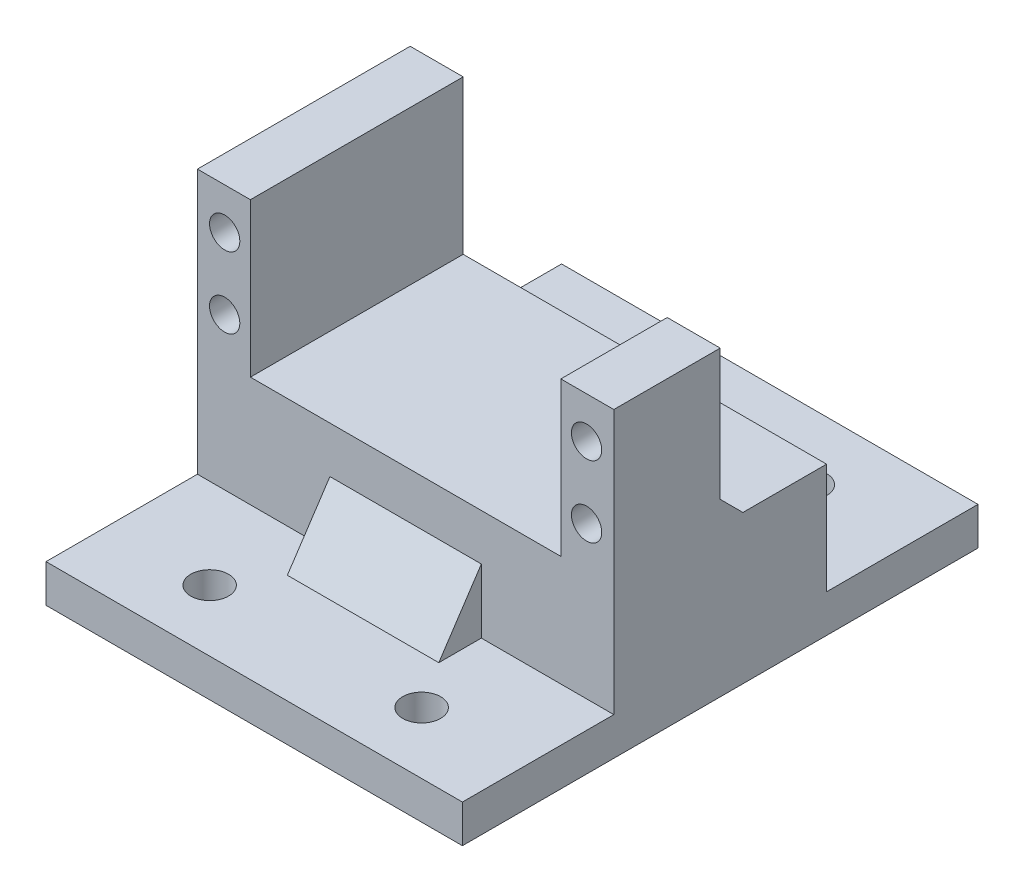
SolidWorks part; units mm, degrees
ref_plane "前视基准面" through (0, 0, 0) normal (0, 0, 1) x (1, 0, 0)
ref_plane "上视基准面" through (0, 0, 0) normal (0, 1, 0) x (1, 0, 0)
ref_plane "右视基准面" through (0, 0, 0) normal (1, 0, 0) x (0, 0, -1)
sketch "草图1" plane through (0, 0, 0) normal (0, 1, 0) x (1, 0, 0)
  line L1 (-18.8462, 12.2436) -> (36.1538, 12.2436)
  line L2 (-18.8462, 12.2436) -> (-18.8462, -15.8564)
  line L3 (-18.8462, -15.8564) -> (36.1538, -15.8564)
  line L4 (36.1538, 12.2436) -> (36.1538, -15.8564)
  dimension "D1" = 55
  dimension "D2" = 28.1
extrude "凸台-拉伸1" add sketch "草图1" along normal blind 39.9
sketch "草图2" plane through (0, 39.9, 0) normal (0, 1, 0) x (1, 0, 0)
  line L0 (8.6538, 12.2436) -> (-11.8462, 12.2436)
  line L1 (36.1538, 12.2436) -> (-18.8462, 12.2436) construction
  line L2 (-11.8462, 12.2436) -> (-11.8462, -15.8564)
  line L3 (-18.8462, -15.8564) -> (36.1538, -15.8564) construction
  line L4 (-11.8462, -15.8564) -> (29.1538, -15.8564)
  line L5 (29.1538, -15.8564) -> (29.1538, 12.2436)
  line L6 (29.1538, 12.2436) -> (8.6538, 12.2436)
extrude "切除-拉伸1" cut sketch "草图2" against normal blind 20.3
sketch "草图3" plane through (0, 0, 15.8564) normal (0, 0, 1) x (1, 0, 0)
  circle A0 centre (-15.2462, 34.45) radius 2
  circle A1 centre (-15.2462, 25.05) radius 2
  circle A2 centre (32.5538, 34.45) radius 2
  circle A3 centre (32.5538, 25.05) radius 2
extrude "切除-拉伸2" cut sketch "草图3" against normal blind 38
sketch "草图6" plane through (0, 0, -12.2436) normal (0, 0, -1) x (-1, 0, 0)
  line L0 (-36.1538, 0) -> (18.8462, 0) construction
  line L1 (-26.2872, 0) -> (10.5458, 0)
  line L2 (-26.2872, 0) -> (-26.2872, 2.8881)
  line L3 (-26.2872, 2.8881) -> (10.5458, 2.8881)
  line L4 (10.5458, 0) -> (10.5458, 2.8881)
extrude "切除-拉伸3" cut sketch "草图6" against normal blind 1
sketch "草图7" plane through (-18.8462, 0, 0) normal (-1, 0, 0) x (0, 0, 1)
  line L0 (-12.2436, 19.95) -> (-47.7434, 0)
  line L1 (-12.2436, 39.9) -> (-12.2436, 0) construction
  line L2 (-47.7434, 0) -> (-12.2436, 0)
  line L3 (-12.2436, 0) -> (-12.2436, 19.95)
  line L4 (15.8564, 19.95) -> (15.8564, 0)
  line L5 (15.8564, 39.9) -> (15.8564, 0) construction
  line L6 (15.8564, 39.9) -> (15.8564, 0) construction
  line L7 (15.8564, 0) -> (41.3165, 0)
  line L8 (41.3165, 0) -> (15.8564, 19.95)
extrude "凸台-拉伸2" add sketch "草图7" against normal up to surface (55 mm away)
sketch "草图9" plane through (0, 0, 0) normal (0, -1, 0) x (1, 0, 0)
  line L0 (36.1538, 41.3165) -> (36.1538, -47.7434) construction
  line L1 (-18.8462, -47.7434) -> (-18.8462, 41.3165) construction
  line L2 (36.1538, -47.7434) -> (-18.8462, -47.7434) construction
  circle A0 centre (-6.8462, -29.8049) radius 2.5
  circle A1 centre (24.1538, -29.7434) radius 2.5
  dimension "D1" = 12
  dimension "D2" = 12
  dimension "D3" = 18
extrude "切除-拉伸5" cut sketch "草图9" against normal blind 44
sketch "草图10" plane through (0, 0, 0) normal (0, -1, 0) x (1, 0, 0)
  circle A0 centre (-6.8462, 30.0096) radius 2.5
  circle A1 centre (24.1538, 30.0096) radius 2.5
extrude "切除-拉伸6" cut sketch "草图10" against normal blind 44
sketch "草图11" plane through (0, 39.9, 0) normal (0, 1, 0) x (1, 0, 0)
  circle A0 centre (24.1538, 29.7434) radius 4
  circle A1 centre (-6.8462, 29.8049) radius 4
  circle A2 centre (-6.8462, -30.0096) radius 4
  circle A3 centre (24.1538, -30.0096) radius 4
  dimension "D1" = 8
  dimension "D2" = 8
  dimension "D3" = 8
  dimension "D4" = 8
extrude "切除-拉伸10" cut sketch "草图11" against normal blind 33
sketch "草图12" plane through (36.1538, 0, 0) normal (1, 0, 0) x (0, 0, -1)
  line L0 (-15.8564, 19.95) -> (-15.8564, 0)
  line L1 (-41.3165, 0) -> (47.7434, 0) construction
  line L2 (-15.8564, 0) -> (-53.9257, 0)
  line L3 (-53.9257, 0) -> (-15.8564, 19.95)
  line L4 (12.2436, 19.95) -> (12.2436, 0)
  line L5 (12.2436, 0) -> (49.0857, 0)
  line L6 (49.0857, 0) -> (12.2436, 19.95)
extrude "切除-拉伸11" cut sketch "草图12" against normal blind 74
sketch "草图13" plane through (36.1538, 0, 0) normal (1, 0, 0) x (0, 0, -1)
  line L0 (-15.8564, 0) -> (-35.8564, 0)
  line L1 (-35.8564, 0) -> (-35.8564, 5)
  line L2 (-35.8564, 5) -> (-15.8564, 5)
  line L3 (-15.8564, 39.9) -> (-15.8564, 0) construction
  line L4 (-15.8564, 5) -> (-15.8564, 0)
  line L5 (12.2436, 0) -> (32.2436, 0)
  line L6 (-15.8564, 0) -> (12.2436, 0) construction
  line L7 (32.2436, 0) -> (32.2436, 5)
  line L8 (32.2436, 5) -> (12.2436, 5)
  line L9 (12.2436, 39.9) -> (12.2436, 0) construction
  line L10 (12.2436, 5) -> (12.2436, 0)
  dimension "D1" = 20
extrude "凸台-拉伸3" add sketch "草图13" against normal up to surface (55 mm away)
sketch "草图14" plane through (0, 5, 0) normal (0, 1, 0) x (1, 0, 0)
  line L1 (-18.8462, 12.2436) -> (-18.8462, 32.2436) construction
  line L2 (36.1538, 32.2436) -> (36.1538, 12.2436) construction
  line L3 (-18.8462, -35.8564) -> (-18.8462, -15.8564) construction
  line L4 (36.1538, -15.8564) -> (36.1538, -35.8564) construction
  circle A0 centre (-5.3462, 23.2642) radius 2.5
  circle A1 centre (22.6538, 23.2642) radius 2.5
  circle A2 centre (-5.3462, -27.741) radius 2.5
  circle A3 centre (22.6538, -27.741) radius 2.5
  point P14 (-18.8462, -25.8564)
  dimension "D1" = 13.5
  dimension "D3" = 13.5
  dimension "D4" = 13.5
  dimension "D2" = 13.5
extrude "切除-拉伸12" cut sketch "草图14" against normal blind 74
ref_plane "基准面1" through (8.6538, 0, 0) normal (-1, 0, 0) x (0, 0, 1)
sketch "草图16" plane through (8.6538, 0, 0) normal (-1, 0, 0) x (0, 0, 1)
  line L0 (-12.2436, 13.4787) -> (-17.8594, 5)
  line L1 (-12.2436, 39.9) -> (-12.2436, 5) construction
  line L2 (-12.2436, 5) -> (-32.2436, 5) construction
rib "筋3" sketch "草图16" sketch "草图16" thickness 20 extrusion direction parallel to sketch draft on no parameters "D1"=20
sketch "草图17" plane through (8.6538, 0, 0) normal (-1, 0, 0) x (0, 0, 1)
  line L0 (15.8564, 13.4787) -> (21.4764, 5)
  line L1 (15.8564, 39.9) -> (15.8564, 5) construction
  line L2 (35.8564, 5) -> (15.8564, 5) construction
  dimension "D1" = 5.62
rib "筋4" sketch "草图17" sketch "草图17" thickness 20 extrusion direction parallel to sketch draft on no parameters "D1"=20
sketch "草图18" plane through (0, 39.9, 0) normal (0, 1, 0) x (1, 0, 0)
  line L0 (29.1538, 12.2436) -> (29.1538, 2.2436)
  line L1 (29.1538, -15.8564) -> (29.1538, 12.2436) construction
  line L3 (36.1538, -15.8564) -> (36.1538, 12.2436) construction
  line L4 (36.1538, 2.2436) -> (36.1538, 12.2436)
  line L5 (36.1538, 12.2436) -> (29.1538, 12.2436)
  line L7 (29.1538, 2.2436) -> (29.1538, -1.8064)
  line L8 (29.1538, -1.8064) -> (36.1538, -1.8064)
  line L9 (36.1538, -1.8064) -> (36.1538, 2.2436)
extrude "切除-拉伸13" cut sketch "草图18" against normal up to surface (20.3 mm away)
chamfer "倒角1" distance 3 angle 45 1 edges at (32.6538, 19.6, 1.8064)
